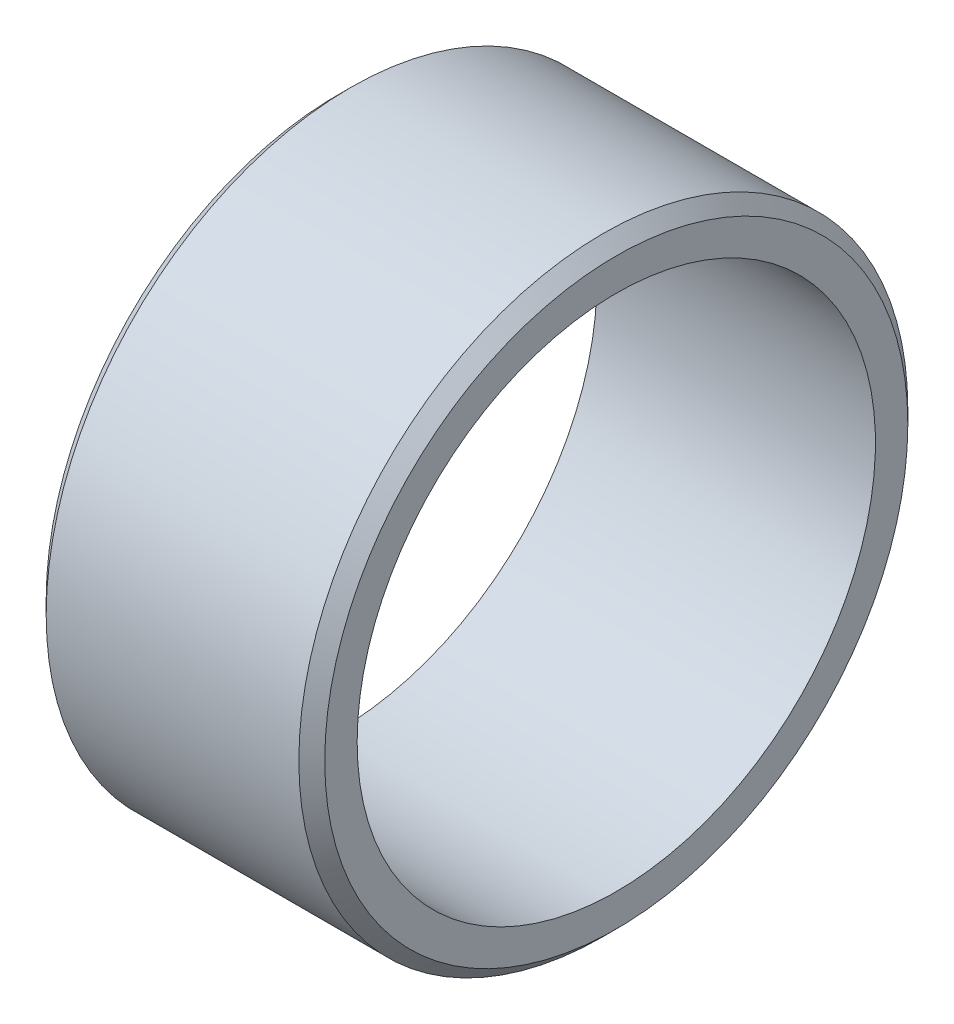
SolidWorks part; units mm, degrees
ref_plane "Plan de face" through (0, 0, 0) normal (0, 0, 1) x (1, 0, 0)
ref_plane "Plan de dessus" through (0, 0, 0) normal (0, 1, 0) x (1, 0, 0)
ref_plane "Plan de droite" through (0, 0, 0) normal (1, 0, 0) x (0, 0, -1)
sketch "Esquisse1" plane through (0, 0, 0) normal (0, 0, 1) x (1, 0, 0)
  line L0 (-20.6639, 0) -> (23.215, 0) construction
  line L1 (-1, 23.5) -> (0, 22.5)
  line L2 (-20.5, 23.5) -> (-1, 23.5)
  line L3 (-21.5, 22.5) -> (-21.5, 20)
  line L4 (-21.5, 20) -> (0, 20)
  line L5 (0, 22.5) -> (0, 20)
  line L6 (-21.5, 22.5) -> (-20.5, 23.5)
  point P3 (-21.5, 23.5)
  point P6 (0, 23.5)
  dimension "D1" = 40
  dimension "D2" = 47
  dimension "D3" = 21.5
  dimension "D4" = 1
  dimension "D5" = 45
  dimension "D6" = 1
  dimension "D7" = 45
revolve "Révolution1" add sketch "Esquisse1" angle 360 about L0
